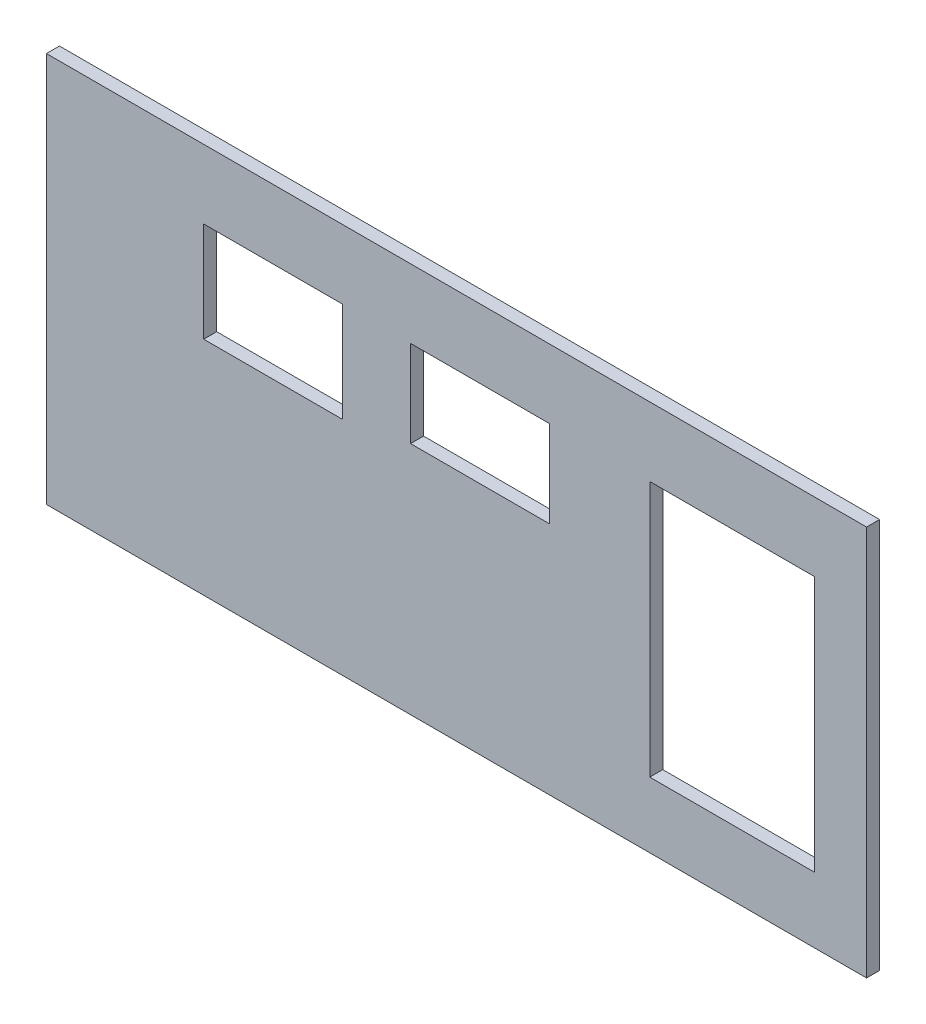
SolidWorks part; units mm, degrees
ref_plane "Plano frontal" through (0, 0, 0) normal (0, 0, 1) x (1, 0, 0)
ref_plane "Plano superior" through (0, 0, 0) normal (0, 1, 0) x (1, 0, 0)
ref_plane "Plano direito" through (0, 0, 0) normal (1, 0, 0) x (0, 0, -1)
sketch "Esboço2" plane through (0, 0, 0) normal (0, 0, 1) x (1, 0, 0)
  line L0 (-65.9785, 37.2037) -> (123.0215, 37.2037)
  line L1 (-65.9785, 37.2037) -> (-65.9785, -52.7963)
  line L2 (-65.9785, -52.7963) -> (123.0215, -52.7963)
  line L3 (123.0215, -52.7963) -> (123.0215, 37.2037)
  line L4 (111.058, 21.3095) -> (111.058, -37.6905)
  line L5 (111.058, -37.6905) -> (73.058, -37.6905)
  line L6 (73.058, -37.6905) -> (73.058, 21.3095)
  line L7 (73.058, 21.3095) -> (111.058, 21.3095)
  line L8 (17.9344, 21.3095) -> (49.9344, 21.3095)
  line L9 (49.9344, 21.3095) -> (49.9344, 1.3095)
  line L10 (49.9344, 1.3095) -> (17.9344, 1.3095)
  line L11 (17.9344, 1.3095) -> (17.9344, 21.3095)
  line L12 (2.2647, 21.3095) -> (-29.7353, 21.3095)
  line L13 (-29.7353, 21.3095) -> (-29.7353, -1.6905)
  line L14 (-29.7353, -1.6905) -> (2.2647, -1.6905)
  line L15 (2.2647, -1.6905) -> (2.2647, 21.3095)
extrude "Ressalto-extrusão1" add sketch "Esboço2" along normal blind 3
